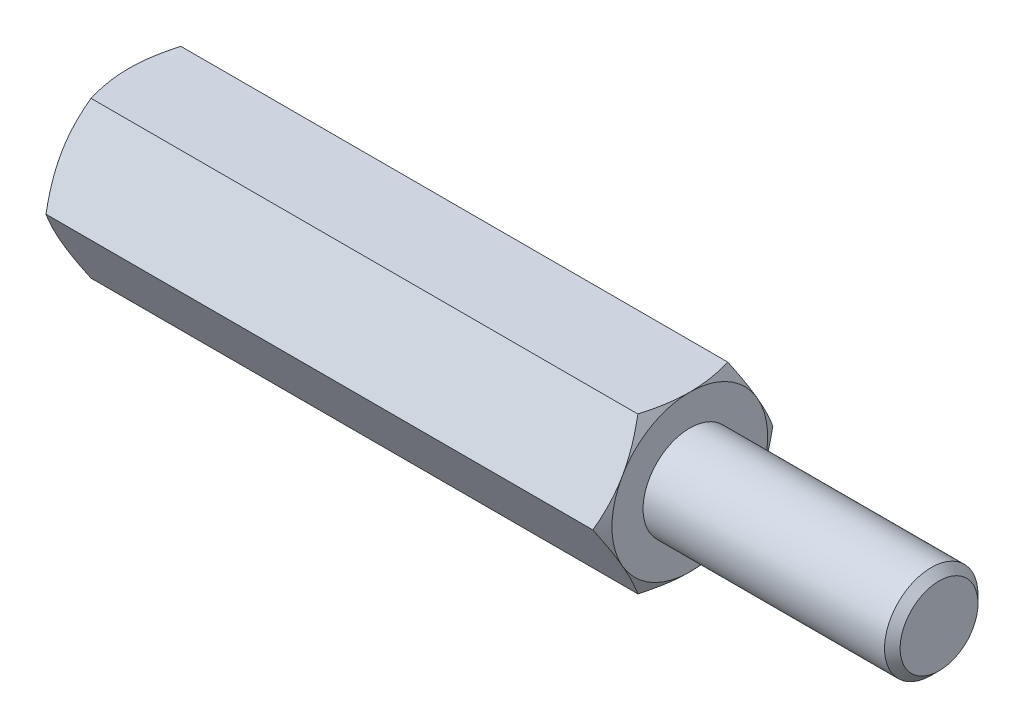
SolidWorks part; units mm, degrees
ref_plane "Front Plane" through (0, 0, 0) normal (0, 0, 1) x (1, 0, 0)
ref_plane "Top Plane" through (0, 0, 0) normal (0, 1, 0) x (1, 0, 0)
ref_plane "Right Plane" through (0, 0, 0) normal (1, 0, 0) x (0, 0, -1)
sketch "Sketch1" plane through (0, 0, 0) normal (1, 0, 0) x (0, 0, -1)
  line L1 (1.4434, 2.5) -> (-1.4434, 2.5)
  line L2 (-1.4434, 2.5) -> (-2.8868, 0)
  line L3 (-2.8868, 0) -> (-1.4434, -2.5)
  line L4 (-1.4434, -2.5) -> (1.4434, -2.5)
  line L5 (1.4434, -2.5) -> (2.8868, 0)
  line L6 (2.8868, 0) -> (1.4434, 2.5)
  circle A0 centre (0, 0) radius 2.5 construction
  dimension "D1" = 5
extrude "Extrude2" add sketch "Sketch1" along normal mid plane 18
sketch "Sketch2" plane through (0, 0, 0) normal (0, 0, 1) x (1, 0, 0)
  line L0 (-9, 2.5) -> (-7.5, 5.0981)
  line L1 (-9, 5.5) -> (-9, 2.5)
  line L3 (0, 0) -> (50000, 0) construction
  arc A0 (-7.5, 5.0981) -> (-9, 5.5) centre (-8.1962, 5.5) ccw
  dimension "D1" = 30
  dimension "D2" = 3
revolve "Cut-Revolve1" cut sketch "Sketch2" angle 360 about L3
mirror "Mirror1" about plane through (0, 0, 0) normal (1, 0, 0) of "Cut-Revolve1"
sketch "Sketch3" plane through (-9, 0, 0) normal (-1, 0, 0) x (0, 0, 1)
  circle A0 centre (0, 0) radius 1.25
  dimension "D1" = 2.5
extrude "Extrude3" cut sketch "Sketch3" against normal blind 8
sketch "Sketch4" plane through (0, 0, 0) normal (0, 0, 1) x (1, 0, 0)
  line L0 (-1, 0) -> (-1, 1.25)
  line L1 (8.7767, 0) -> (-8.7767, 0) construction
  line L2 (-1, 1.25) -> (-0.2783, 0)
  line L3 (-0.2783, 0) -> (-1, 0)
  line L4 (-9, 1.25) -> (-9, -1.25) construction
  point P4 (-9, 0)
  dimension "D1" = 30
  dimension "D2" = 1.25
  dimension "D3" = 8
revolve "Cut-Revolve2" cut sketch "Sketch4" angle 360 about L3
sketch "Sketch5" plane through (9, 0, 0) normal (1, 0, 0) x (0, 0, -1)
  circle A0 centre (0, 0) radius 1.5
  dimension "D1" = 3
extrude "Extrude4" add sketch "Sketch5" along normal blind 8
chamfer "Chamfer1" distance 0.25 angle 45 1 edges at (17, 0, -1.5)
equation "\"D2@Sketch4\" = \"D1@Sketch3\"/2"
